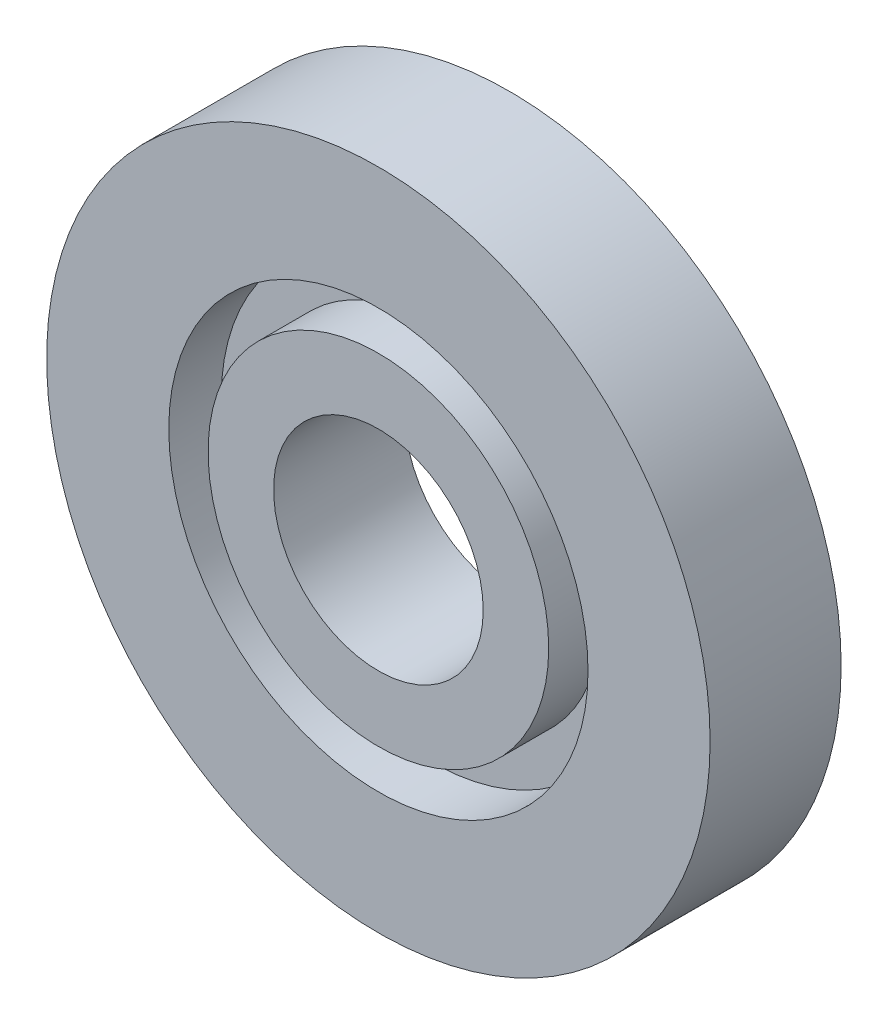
SolidWorks part; units mm, degrees
ref_plane "Alzado" through (0, 0, 0) normal (0, 0, 1) x (1, 0, 0)
ref_plane "Planta" through (0, 0, 0) normal (0, 1, 0) x (1, 0, 0)
ref_plane "Vista lateral" through (0, 0, 0) normal (1, 0, 0) x (0, 0, -1)
sketch "Croquis1" plane through (0, 0, 0) normal (0, 0, 1) x (1, 0, 0)
  circle A0 centre (0, 0) radius 6.33
  circle A1 centre (0, 0) radius 2.35
  dimension "D1" = 12.66
  dimension "D2" = 4.7
extrude "Saliente-Extruir2" add sketch "Croquis1" along normal blind 2.5 contours A0 A1
sketch "Croquis2" plane through (0, 0, 2.5) normal (0, 0, 1) x (1, 0, 0)
  circle A0 centre (0, 0) radius 2
  dimension "D1" = 4
extrude "Cortar-Extruir1" cut sketch "Croquis2" against normal blind 5
sketch "Croquis3" plane through (0, 0, 2.5) normal (0, 0, 1) x (1, 0, 0)
  circle A0 centre (0, 0) radius 4
  circle A1 centre (0, 0) radius 3.25
  dimension "D1" = 8
  dimension "D2" = 6.5
extrude "Cortar-Extruir2" cut sketch "Croquis3" against normal blind 1 contours A1 M3 | A0
sketch "Croquis4" plane through (0, 0, 0) normal (0, 0, -1) x (-1, 0, 0)
  circle A0 centre (0, 0) radius 4
  circle A1 centre (0, 0) radius 3.25
  dimension "D1" = 8
  dimension "D2" = 6.5
extrude "Cortar-Extruir3" cut sketch "Croquis4" against normal blind 1
